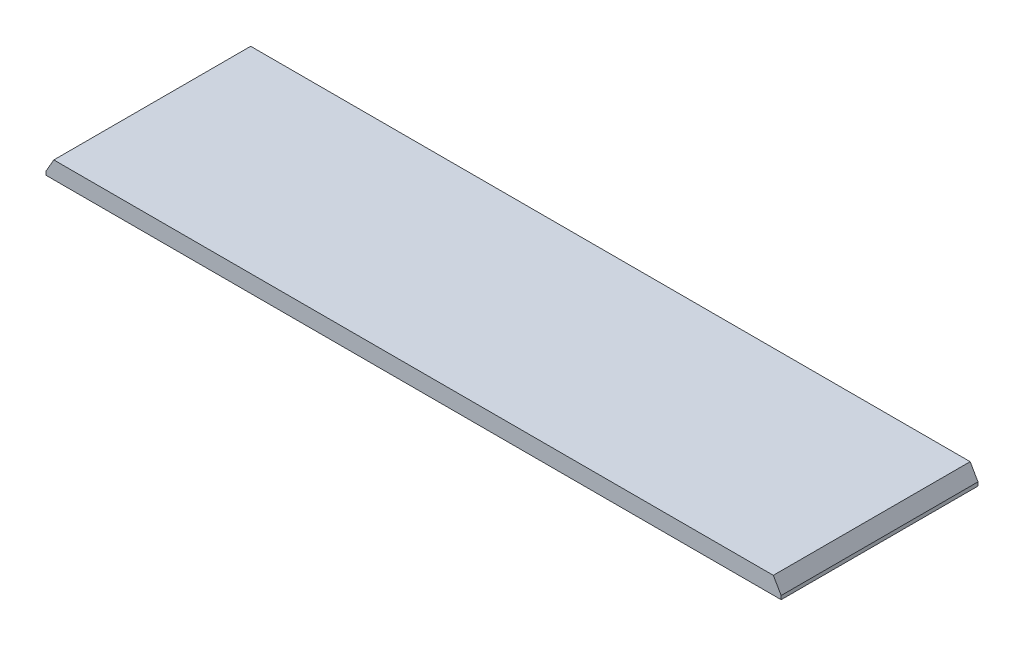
SolidWorks part; units mm, degrees
ref_plane "Front Plane" through (0, 0, 0) normal (1, 0, 0) x (0, 1, 0)
ref_plane "Top Plane" through (0, 0, 0) normal (0, 0, 1) x (0, 1, 0)
ref_plane "Right Plane" through (0, 0, 0) normal (0, 1, 0) x (-1, 0, 0)
sketch "sk w193" plane through (0, 0, 0) normal (0, 0, 1) x (0, 1, 0)
  point P0 (-399.034, -196.596)
  point P3 (-188.214, 0)
  line B0 (-399.034, -196.596) -> (-399.034, -160.02)
  line B1 (-399.034, -160.02) -> (-226.06, -160.02)
  line B2 (-210.82, -144.78) -> (-210.82, 144.78)
  line B3 (-226.06, 160.02) -> (-399.034, 160.02)
  line B4 (-399.034, 160.02) -> (-399.034, 196.596)
  line B5 (-399.034, 196.596) -> (0, 196.596)
  line B6 (0, 196.596) -> (0, 160.02)
  line B7 (0, 160.02) -> (-172.974, 160.02)
  line B8 (-188.214, 144.78) -> (-188.214, -144.78)
  line B9 (-172.974, -160.02) -> (0, -160.02)
  line B10 (0, -160.02) -> (0, -196.596)
  line B11 (0, -196.596) -> (-399.034, -196.596)
  arc B12 (-226.06, -160.02) -> (-210.82, -144.78) centre (-226.06, -144.78) ccw
  arc B13 (-210.82, 144.78) -> (-226.06, 160.02) centre (-226.06, 144.78) ccw
  arc B14 (-172.974, 160.02) -> (-188.214, 144.78) centre (-172.974, 144.78) ccw
  arc B15 (-188.214, -144.78) -> (-172.974, -160.02) centre (-172.974, -144.78) ccw
sketch_block_instance "w14x193-1-1"
sketch_block "w14x193-1" parameters "D4"=15.24, "D1"=399.034, "D2"=393.192, "D3"=22.606, "D5"=36.576
sketch "Sketch2" plane through (0, 0, 0) normal (0, 0, 1) x (0, 1, 0)
  line L0 (320, 501.4782) -> (320, -809.7231)
  line L1 (-188.214, 144.78) -> (-188.214, -144.78)
  line L2 (-188.214, -144.78) -> (-172.974, -160.02)
  line L3 (-172.974, -160.02) -> (5, -160.02)
  line L4 (-188.214, 144.78) -> (-172.974, 160.02)
  line L5 (-172.974, 160.02) -> (5, 160.02)
  line L6 (5, 201.596) -> (5, 160.02)
  line L7 (0, 196.596) -> (0, 160.02) construction
  line L8 (5, -160.02) -> (5, -201.596)
  line L9 (-285.82, 201.596) -> (5, 201.596)
  line L10 (-285.82, -201.596) -> (5, -201.596)
  line L11 (-285.82, 201.596) -> (-285.82, 239.696)
  line L12 (-285.82, 239.696) -> (167.6, 501.4782)
  line L13 (-285.82, -201.596) -> (-285.82, -239.696)
  line L14 (-285.82, -239.696) -> (167.6, -809.7231)
  line L15 (-210.82, -144.78) -> (-210.82, 144.78) construction
  line L16 (-399.034, 196.596) -> (0, 196.596) construction
  line L17 (0, -196.596) -> (-399.034, -196.596) construction
  line L18 (320, 501.4782) -> (167.6, 501.4782)
  line L19 (320, -809.7231) -> (167.6, -809.7231)
  point P30 (320, 501.4782)
  point P31 (320, -809.7231)
  dimension "D1" = 320
  dimension "D2" = 5
  dimension "D3" = 75
  dimension "D4" = 5
  dimension "D5" = 5
  dimension "D6" = 30
  dimension "D7" = 51.5
  dimension "D8" = 38.1
  dimension "D9" = 38.1
  dimension "D10" = 152.4
sketch "Sketch3" plane through (0, 0, 0) normal (0, 1, 0) x (-1, 0, 0)
  line L6 (-541.5415, 145) -> (541.5415, 145)
  line L7 (-541.5415, 145) -> (-541.5415, -145)
  line L8 (-541.5415, -145) -> (541.5415, -145)
  line L9 (541.5415, 145) -> (541.5415, -145)
  point P4 (0, 145)
  point P5 (541.5415, 0)
  dimension "D1" = 290
  dimension "D2" = 1083.083
extrude "Boss-Extrude1" add sketch "Sketch3" along normal blind 25.4
chamfer "Chamfer1" distance 20 angle 30 2 edges at (-541.5415, 25.4, 0) (541.5415, 25.4, 0)
